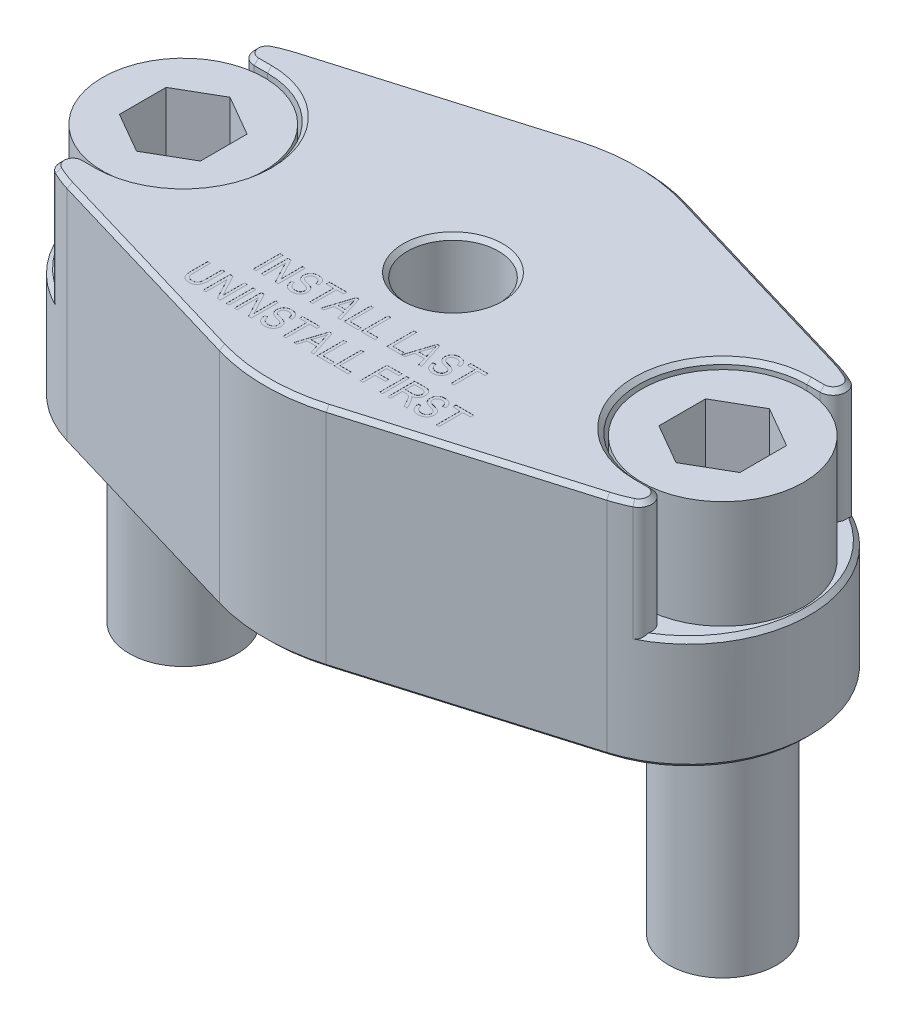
SolidWorks part; units mm, degrees
other "<SHCS50-13L1.50>-<HEX>"
ref_plane "Front Plane" through (0, 0, 0) normal (0, 0, 1) x (1, 0, 0)
ref_plane "Top Plane" through (0, 0, 0) normal (0, 1, 0) x (1, 0, 0)
ref_plane "Right Plane" through (0, 0, 0) normal (1, 0, 0) x (0, 0, -1)
sketch "Sketch1" plane through (0, 0, 0) normal (0, 1, 0) x (1, 0, 0)
  line L0 (-6.2862, 21.2115) -> (-31.7603, 13.6621)
  line L1 (-31.7603, -13.6621) -> (-6.2862, -21.2115)
  line L2 (6.2862, -21.2115) -> (31.7603, -13.6621)
  line L3 (31.7603, 13.6621) -> (6.2862, 21.2115)
  line L4 (-27.7114, 0) -> (27.7114, 0) construction
  line L5 (0, 0) -> (0, 22.9186) construction
  arc A0 (-6.2862, -21.2115) -> (6.2862, -21.2115) centre (0, 0) ccw
  arc A1 (-31.7603, 13.6621) -> (-31.7603, -13.6621) centre (-27.7114, 0) ccw
  arc A2 (31.7603, -13.6621) -> (31.7603, 13.6621) centre (27.7114, 0) ccw
  arc A3 (6.2862, 21.2115) -> (-6.2862, 21.2115) centre (0, 0) ccw
  circle A4 centre (-31.75, 0) radius 6.731
  circle A5 centre (31.75, 0) radius 6.731
  dimension "D1" = 44.2468
  dimension "D2" = 14.2494
  dimension "D3" = 83.9216
  dimension "D5" = 31.75
  dimension "D6" = 13.462
  dimension "D4" = 16.508
extrude "Boss-Extrude1" add sketch "Sketch1" along normal blind 26.7208
sketch "Sketch2" plane through (0, 0, 0) normal (0, -1, 0) x (1, 0, 0)
  circle A0 centre (0, 0) radius 19.177
  dimension "D1" = 38.354
extrude "Cut-Extrude1" cut sketch "Sketch2" against normal blind 12.7
fillet "Fillet1" radius 0.508 1 edges at (0, 12.7, -19.177)
sketch "Sketch3" plane through (0, 26.7208, 0) normal (0, 1, 0) x (1, 0, 0)
  line L0 (-31.75, 9.906) -> (-41.9608, 9.906)
  line L1 (-41.9608, 9.906) -> (-41.9608, -9.906)
  line L2 (-41.9608, -9.906) -> (-31.75, -9.906)
  line L3 (31.75, 9.906) -> (41.9608, 9.906)
  line L4 (41.9608, 9.906) -> (41.9608, -9.906)
  line L5 (41.9608, -9.906) -> (31.75, -9.906)
  arc A0 (-31.75, -9.906) -> (-31.75, 9.906) centre (-31.75, 0) ccw
  arc A1 (31.75, 9.906) -> (31.75, -9.906) centre (31.75, 0) ccw
  arc A2 (-31.7603, 13.6621) -> (-31.7603, -13.6621) centre (-27.7114, 0) ccw construction
  arc A3 (31.7603, -13.6621) -> (31.7603, 13.6621) centre (27.7114, 0) ccw construction
  dimension "D1" = 19.812
extrude "Cut-Extrude2" cut sketch "Sketch3" against normal blind 13.462
hole_wizard "1/2-13 Tapped Hole1" positions "Sketch4" profile "Sketch5" tap size "1/2-13" standard "ANSI Inch"
sketch "Sketch4" plane through (0, 26.7208, 0) normal (0, 1, 0) x (1, 0, 0)
  point P0 (0, 0)
sketch "Sketch5" plane through (0, 26.7208, 0) normal (1, 0, 0) x (0, 0, 1)
  line L0 (0, 0) -> (0, 26.7208)
  line L1 (0, 26.7208) -> (5.3581, 26.7208)
  line L2 (5.3581, 26.7208) -> (5.3581, 0)
  line L5 (5.3581, 0) -> (0, 0)
  line L11 (0, -6.35) -> (0, 107.95) construction
  dimension "Thru Tap Drill Dia." = 10.7163
  dimension "Thru Tap Drill Depth" = 26.7208
fillet "Fillet2" radius 1.524 4 edges at (37.9543, 19.9898, -9.906) (37.9543, 19.9898, 9.906) (-37.9543, 19.9898, 9.906) (-37.9543, 19.9898, -9.906)
chamfer "Chamfer1" distance 0.508 angle 45 34 edges at (19.0232, 26.7208, -17.4368) (32.8857, 26.7208, -13.2767) (32.8857, 26.7208, 13.2767) (19.0232, 26.7208, 17.4368) (0, 26.7208, 22.1234) (-19.0232, 26.7208, 17.4368) (-32.8857, 26.7208, -13.2767) (-32.8857, 26.7208, 13.2767) (-19.0232, 26.7208, -17.4368) (0, 26.7208, -22.1234) (21.844, 26.7208, 0) (-21.844, 26.7208, 0) (0, 26.7208, 5.3581) (31.75, 0, 6.731) (0, 0, -19.177) (-31.75, 0, 6.731) (19.0232, 0, -17.4368) (0, 0, -22.1234) (41.9608, 0, 0) (-19.0232, 0, -17.4368) (19.0232, 0, 17.4368) (-41.9608, 0, 0) (0, 0, 22.1234) (-19.0232, 0, 17.4368) (-32.5276, 26.7208, -9.906) (32.5276, 26.7208, -9.906) (32.5276, 26.7208, 9.906) (-32.5276, 26.7208, 9.906) (34.7899, 26.7208, 11.0862) (-34.7899, 26.7208, 11.0862) (-34.7899, 26.7208, -11.0862) (34.7899, 26.7208, -11.0862) (41.9608, 13.2588, 0) (-41.9608, 13.2588, 0)
sketch "Sketch6" plane through (0, 26.7208, 0) normal (0, 1, 0) x (1, 0, 0)
  line L0 (-19.05, -11.43) -> (19.05, -11.43) construction
  line L1 (0, 21.6154) -> (0, -22.1234) construction
  line L3 (-19.05, -16.51) -> (19.05, -16.51) construction
  arc A0 (6.1419, 20.7245) -> (-6.1419, 20.7245) centre (0, 0) ccw construction
  arc A1 (-6.2862, -21.2115) -> (6.2862, -21.2115) centre (0, 0) ccw construction
  text T0 "INSTALL LAST" font "Arial Narrow" height 3.175
  text T2 "UNINSTALL FIRST" font "Arial Narrow" height 3.175
  point P14 (0, -11.43)
  dimension "D2" = 38.1
  dimension "D4" = 11.43
  dimension "D5" = 5.08
extrude "Cut-Extrude3" cut sketch "Sketch6" against normal blind 0.0127
inserted part "SHCS50-13L1.50"
move or copy body "Body-Move/Copy2" placed by mates yes parameters "D1"=0, "D2"=0, "D3"=0
mirror "Mirror1" about plane through (0, 0, 0) normal (1, 0, 0)
